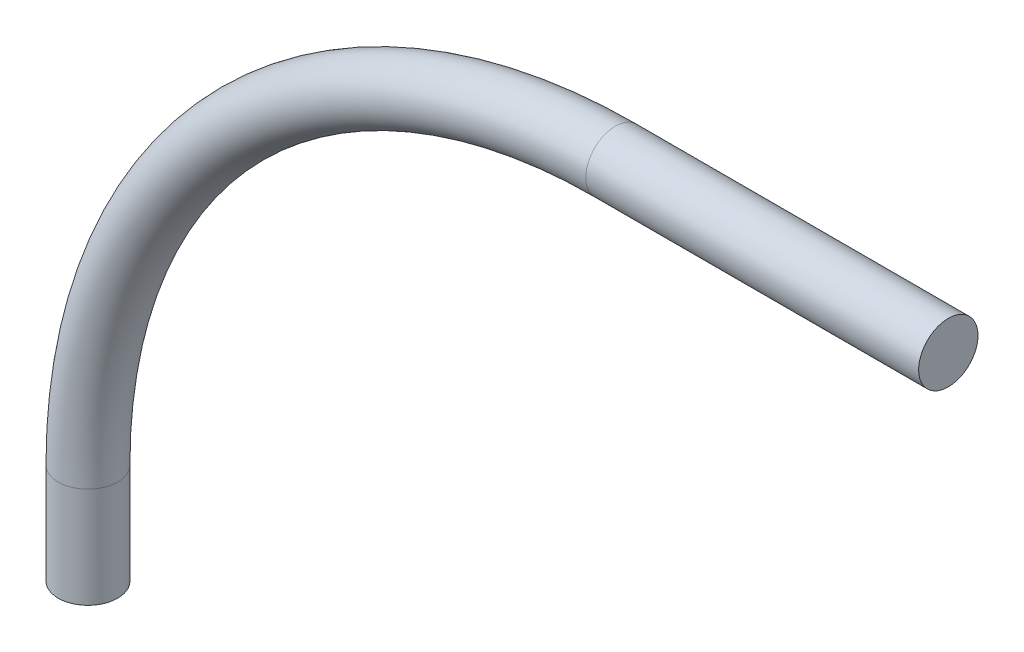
SolidWorks part; units mm, degrees
ref_plane "Front" through (0, 0, 0) normal (0, 0, 1) x (1, 0, 0)
ref_plane "Top" through (0, 0, 0) normal (0, 1, 0) x (1, 0, 0)
ref_plane "Right" through (0, 0, 0) normal (1, 0, 0) x (0, 0, -1)
sketch "Sketch1" plane through (0, 0, 0) normal (0, 0, 1) x (1, 0, 0)
  line L0 (-152, 350) -> (-152, 278)
  line L1 (463.75, 727.5) -> (225.5, 727.5)
  line L2 (-152, 278) -> (-152, 268) construction
  line L3 (463.75, 727.5) -> (225.5, 727.5) construction
  line L4 (463.75, 752.5) -> (463.75, 702.5) construction
  line L5 (473, 752.5) -> (463.75, 752.5) construction
  line L7 (-130.25, 278) -> (-173.75, 278) construction
  arc A0 (-152, 350) -> (225.5, 727.5) centre (225.5, 350) cw
  dimension "D1" = 25
  dimension "D2" = 72
sketch "Sketch2" plane through (0, 278, 0) normal (0, -1, 0) x (1, 0, 0)
  circle A0 centre (-152, 0) radius 21.25
  arc A1 (-152, 25) -> (-177, 0) centre (-152, 0) ccw construction
  dimension "D1" = 42.5
sweep "Sweep1" add profiles "Sketch2" path "Sketch1"
